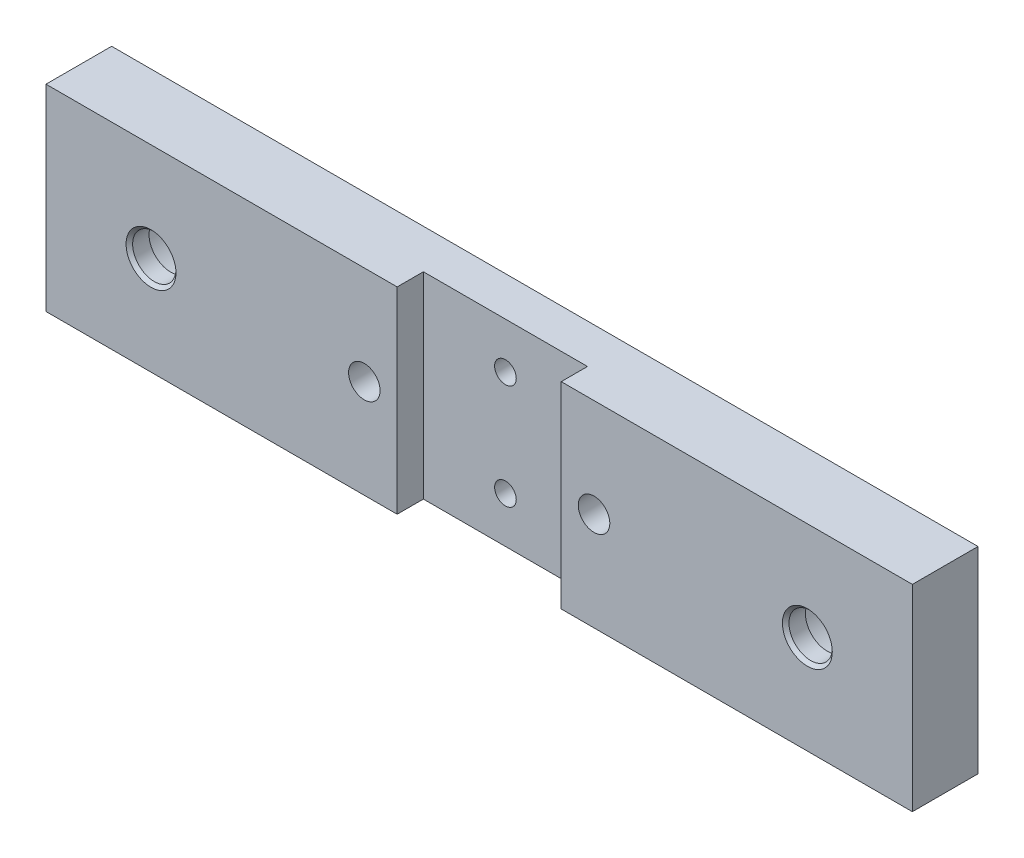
SolidWorks part; units mm, degrees
ref_plane "Face" through (0, 0, 0) normal (0, 0, 1) x (1, 0, 0)
ref_plane "Dessus" through (0, 0, 0) normal (0, 1, 0) x (1, 0, 0)
ref_plane "Droite" through (0, 0, 0) normal (1, 0, 0) x (0, 0, -1)
sketch "Esquisse1" plane through (0, 0, 0) normal (0, 0, 1) x (1, 0, 0)
  line L1 (-66, 15) -> (66, 15)
  line L2 (-66, 15) -> (-66, -15)
  line L3 (-66, -15) -> (66, -15)
  line L4 (66, 15) -> (66, -15)
  dimension "D1" = 132
  dimension "D2" = 66
  dimension "D3" = 30
  dimension "D4" = 15
extrude "Extrusion1" add sketch "Esquisse1" along normal blind 10
sketch "Esquisse2" plane through (0, 0, 10) normal (0, 0, 1) x (1, 0, 0)
  line L1 (-12.5, 31.3269) -> (12.5, 31.3269)
  line L2 (-12.5, 31.3269) -> (-12.5, -31.9597)
  line L3 (-12.5, -31.9597) -> (12.5, -31.9597)
  line L4 (12.5, 31.3269) -> (12.5, -31.9597)
  dimension "D1" = 25
  dimension "D2" = 12.5
extrude "Enlèv. mat.-Extru.1" cut sketch "Esquisse2" against normal blind 4
hole_wizard "Chambrage pour vis à tête cylindrique fendue M61" positions "Esquisse4" profile "Esquisse3" counterbore size "M6" standard "ISO"
sketch "Esquisse4" plane through (0, 0, 0) normal (0, 0, -1) x (-1, 0, 0)
  line L0 (69.5361, 0) -> (-72.2258, 0) construction
  point P0 (50, 0)
  point P1 (-50, 0)
  dimension "D1" = 100
  dimension "D2" = 50
sketch "Esquisse3" plane through (-50, 0, 0) normal (1, 0, 0) x (0, 1, 0)
  line L0 (0, 0) -> (0, 11.9828)
  line L1 (0, 11.9828) -> (3.3, 10)
  line L2 (3.3, 10) -> (3.3, 7)
  line L3 (3.3, 7) -> (6.25, 7)
  line L4 (6.25, 7) -> (6.25, 0)
  line L5 (6.25, 0) -> (0, 0)
  line L10 (0, 11.9828) -> (-3.3, 10) construction
  line L11 (0, -6.35) -> (0, 107.95) construction
  dimension "Diamètre du perçage" = 6.6
  dimension "Profondeur du perçage" = 10
  dimension "Diamètre du chambrage" = 12.5
  dimension "Profondeur du chambrage" = 7
  dimension "Angle de pointe" = 118
chamfer "Chanfrein1" distance 0.5 angle 45
hole_wizard "Trou taraudé M6x1.01" positions "Esquisse6" profile "Esquisse5" tap size "M6x1.0" standard "ISO"
sketch "Esquisse6" plane through (0, 0, 0) normal (0, 0, -1) x (-1, 0, 0)
  line L0 (37.4182, 0) -> (-62.7328, 0) construction
  point P0 (17.5, 0)
  point P1 (-17.5, 0)
  dimension "D1" = 35
  dimension "D2" = 17.5
sketch "Esquisse5" plane through (-17.5, 0, 0) normal (1, 0, 0) x (0, 1, 0)
  line L0 (0, 0) -> (0, 10)
  line L1 (0, 10) -> (2.4, 10)
  line L2 (2.4, 10) -> (2.4, 0)
  line L5 (2.4, 0) -> (0, 0)
  line L11 (0, -6.35) -> (0, 107.95) construction
  dimension "Diamètre du trou pour taraudage jusqu'au prochain" = 4.8
  dimension "Profondeur du trou pour taraudage jusqu'au prochain" = 10
hole_wizard "Trou taraudé M4x0.71" positions "Esquisse8" profile "Esquisse7" tap size "M4x0.7" standard "ISO"
sketch "Esquisse8" plane through (0, 0, 0) normal (0, 0, -1) x (-1, 0, 0)
  line L0 (0, 25.6311) -> (0, -26.4222) construction
  point P0 (0, 8)
  point P1 (0, -8)
  dimension "D1" = 16
  dimension "D2" = 8
sketch "Esquisse7" plane through (0, 8, 0) normal (1, 0, 0) x (0, 1, 0)
  line L0 (0, 0) -> (0, 10)
  line L1 (0, 10) -> (1.65, 10)
  line L2 (1.65, 10) -> (1.65, 0)
  line L5 (1.65, 0) -> (0, 0)
  line L11 (0, -6.35) -> (0, 107.95) construction
  dimension "Diamètre du trou pour taraudage jusqu'au prochain" = 3.3
  dimension "Profondeur du trou pour taraudage jusqu'au prochain" = 10
